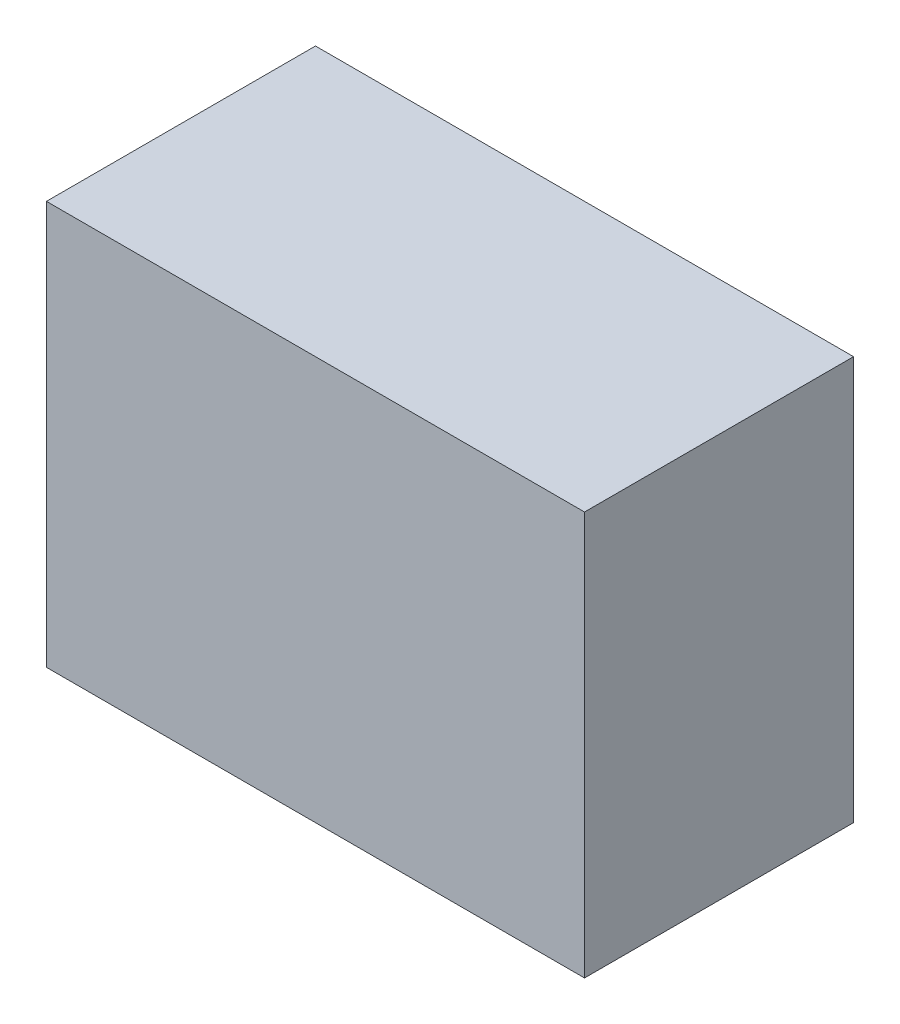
SolidWorks part; units mm, degrees
ref_plane "Front Plane" through (0, 0, 0) normal (0, 0, 1) x (1, 0, 0)
ref_plane "Top Plane" through (0, 0, 0) normal (0, 1, 0) x (1, 0, 0)
ref_plane "Right Plane" through (0, 0, 0) normal (1, 0, 0) x (0, 0, -1)
sketch "Sketch1" plane through (0, 0, 0) normal (0, 1, 0) x (1, 0, 0)
  line L1 (-1, -0.5) -> (1, -0.5)
  line L2 (-1, -0.5) -> (-1, 0.5)
  line L3 (-1, 0.5) -> (1, 0.5)
  line L4 (1, -0.5) -> (1, 0.5)
  line L5 (-1, -0.5) -> (1, 0.5) construction
  line L6 (-1, 0.5) -> (1, -0.5) construction
  point P0 (0, 0)
  dimension "D1" = 1
  dimension "D2" = 2
extrude "Boss-Extrude1" add sketch "Sketch1" along normal blind 1.5
